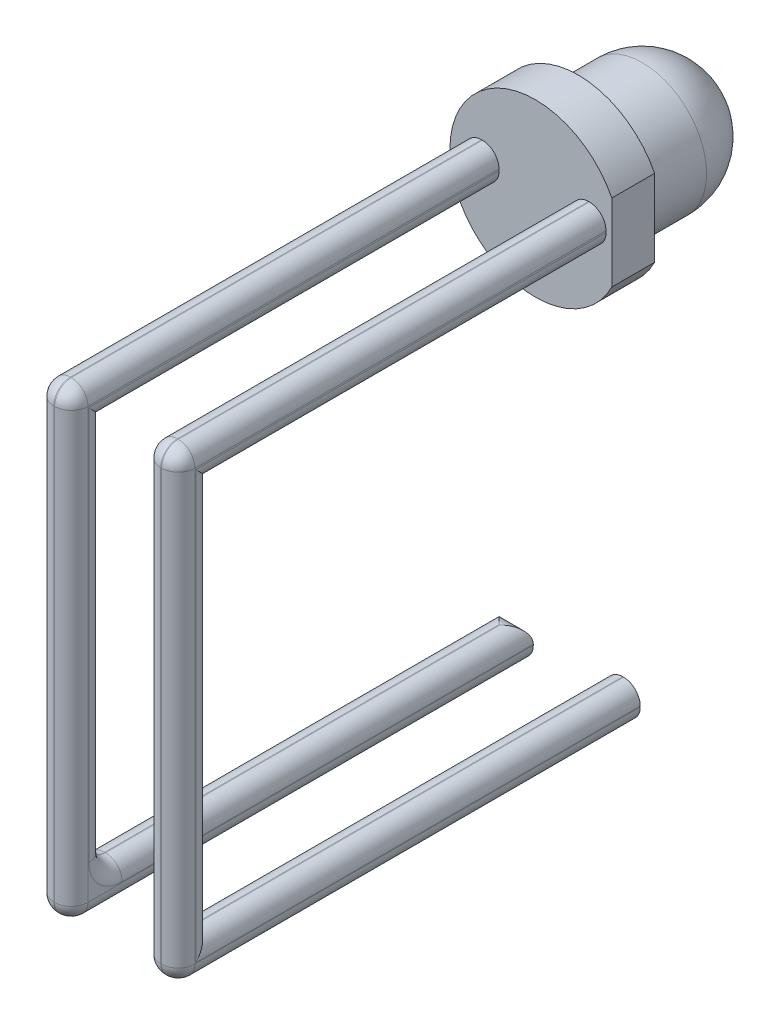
SolidWorks part; units mm, degrees
ref_plane "Face" through (0, 0, 0) normal (0, 0, 1) x (1, 0, 0)
ref_plane "Dessus" through (0, 0, 0) normal (0, 1, 0) x (1, 0, 0)
ref_plane "Droite" through (0, 0, 0) normal (1, 0, 0) x (0, 0, -1)
sketch "Esquisse1" plane through (0, 0, 0) normal (0, 0, 1) x (1, 0, 0)
  circle A0 centre (0, 0) radius 1.5
  dimension "D1" = 3
extrude "Base-Extrusion" add sketch "Esquisse1" along normal blind 4
sketch "Esquisse2" plane through (0, 0, 4) normal (0, 0, 1) x (1, 0, 0)
  line L0 (1.7857, -2.4917) -> (1.7857, 2.5621) construction
  line L1 (1.7857, 0.9007) -> (1.7857, -0.9007)
  arc A0 (1.7857, 0.9007) -> (1.7857, -0.9007) centre (0, 0) ccw
  dimension "D1" = 2
extrude "Boss.-Extru.1" add sketch "Esquisse2" against normal blind 1
fillet "Congé1" radius 1.5 1 edges at (1.5, 0, 0)
sketch "Esquisse4" plane through (0, 0, 0) normal (1, 0, 0) x (0, 0, -1)
  line L0 (1.383, 0) -> (-18.292, 0) construction
  line L1 (-14, 2.6212) -> (-14, -6.3201) construction
  line L2 (-12, 4.5057) -> (-12, -7.4301) construction
  line L3 (-13.5, 4.822) -> (-13.5, -7.8308) construction
  line L4 (-0.3251, -3) -> (-18.0389, -3) construction
  line L5 (-14, 0.559) -> (-14, -0.2613)
  line L6 (-15.7458, -1.1795) -> (-1.7638, -1.4542) construction
  line L7 (-4, -0.2613) -> (-4, 0.559)
  line L8 (-6, 4.1261) -> (-6, -7.641) construction
  line L10 (-4, -0.2613) -> (-14, -0.2613)
  line L12 (-4, 0.559) -> (-14, 0.559)
  line L13 (-4, 2) -> (-4, -2) construction
  dimension "D2" = 10
extrude "Boss.-Extru.2" add sketch "Esquisse4" along normal mid plane 3.3
sketch "Esquisse5" plane through (0, 0, 4) normal (0, 0, 1) x (1, 0, 0)
  line L0 (0, 2.2833) -> (0, -3.6189) construction
  line L1 (-0.85, 0.9378) -> (-0.85, -3.7624) construction
  line L2 (0.85, 0.8751) -> (0.85, -3.6906) construction
  line L4 (-0.85, 0.6239) -> (0.85, 0.6239)
  line L5 (-0.85, 0.6239) -> (-0.85, -17.2001)
  line L6 (-0.85, -17.2001) -> (0.85, -17.2001)
  line L7 (0.85, 0.6239) -> (0.85, -17.2001)
extrude "Enlèv. mat.-Extru.1" cut sketch "Esquisse5" along normal blind 10
sketch "Esquisse6" plane through (0, -0.2613, 0) normal (0, -1, 0) x (1, 0, 0)
  line L0 (0.85, 4) -> (0.85, 14) construction
  line L1 (1.65, 14) -> (0.85, 14)
  line L2 (1.65, 14) -> (1.65, 13.2)
  line L3 (1.65, 13.2) -> (0.85, 13.2)
  line L4 (0.85, 14) -> (0.85, 13.2)
  line L5 (-1.65, 14) -> (-1.65, 4) construction
  line L6 (-0.85, 14) -> (-1.65, 14)
  line L7 (-0.85, 14) -> (-0.85, 13.2)
  line L8 (-0.85, 13.2) -> (-1.65, 13.2)
  line L9 (-1.65, 14) -> (-1.65, 13.2)
  dimension "D1" = 0.8
extrude "Extrusion1" add sketch "Esquisse6" along normal blind 10
sketch "Esquisse7" plane through (0, 0, 13.2) normal (0, 0, -1) x (-1, 0, 0)
  line L0 (-0.85, -10.2613) -> (-0.85, -0.2613) construction
  line L1 (-1.65, -10.2613) -> (-0.85, -10.2613)
  line L2 (-1.65, -10.2613) -> (-1.65, -9.4613)
  line L3 (-1.65, -9.4613) -> (-0.85, -9.4613)
  line L4 (-0.85, -10.2613) -> (-0.85, -9.4613)
  line L5 (1.65, -10.2613) -> (1.65, -0.2613) construction
  line L6 (0.85, -10.2613) -> (1.65, -10.2613)
  line L7 (0.85, -10.2613) -> (0.85, -9.4613)
  line L8 (0.85, -9.4613) -> (1.65, -9.4613)
  line L9 (1.65, -10.2613) -> (1.65, -9.4613)
  dimension "D1" = 0.8
extrude "Extrusion2" add sketch "Esquisse7" along normal blind 10
fillet "Congé2" radius 0.39 28 edges at (-1.65, 0.559, 9) (-1.65, -4.8511, 14) (1.25, 0.559, 14) (1.65, 0.559, 9) (1.65, -4.8511, 14) (-1.25, 0.559, 14) (0.85, -4.8511, 14) (-0.85, -4.8511, 14) (0.85, -0.2613, 8.6) (-0.85, 0.559, 9) (0.85, 0.559, 9) (1.65, -0.2613, 8.6) (1.65, -10.2613, 8.6) (1.25, -10.2613, 14) (0.85, -10.2613, 8.6) (-0.85, -0.2613, 8.6) (-1.65, -0.2613, 8.6) (-0.85, -10.2613, 8.6) (-1.25, -10.2613, 14) (-1.65, -10.2613, 8.6) (1.65, -4.8613, 13.2) (0.85, -4.8613, 13.2) (1.65, -9.4613, 8.2) (0.85, -9.4613, 8.2) (-0.85, -4.8613, 13.2) (-1.65, -4.8613, 13.2) (-0.85, -9.4613, 8.2) (-1.65, -9.4613, 8.2)
